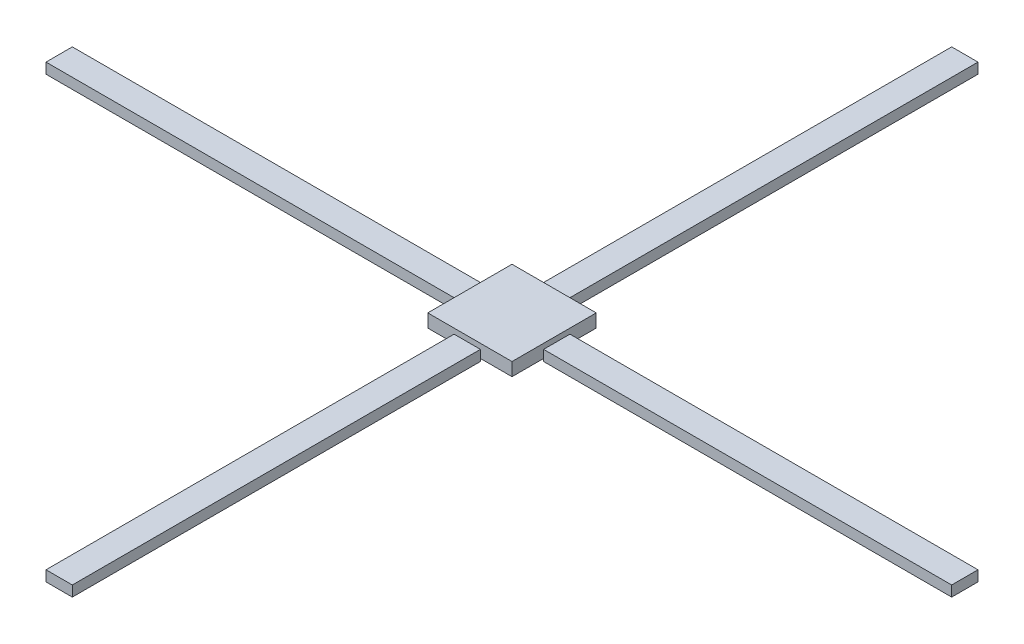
SolidWorks part; units mm, degrees
ref_plane "Front Plane" through (0, 0, 0) normal (0, 0, 1) x (1, 0, 0)
ref_plane "Top Plane" through (0, 0, 0) normal (0, 1, 0) x (1, 0, 0)
ref_plane "Right Plane" through (0, 0, 0) normal (1, 0, 0) x (0, 0, -1)
sketch "Sketch1" plane through (0, 0, 0) normal (0, 1, 0) x (1, 0, 0)
  line L1 (8500, -2500) -> (86000, -2500)
  line L2 (8500, -2500) -> (8500, 2500)
  line L3 (8500, 2500) -> (86000, 2500)
  line L4 (86000, -2500) -> (86000, 2500)
  line L5 (-86000, -2500) -> (-8500, -2500)
  line L6 (-86000, -2500) -> (-86000, 2500)
  line L7 (-86000, 2500) -> (-8500, 2500)
  line L8 (-8500, -2500) -> (-8500, 2500)
  line L9 (-2500, 8500) -> (2500, 8500)
  line L10 (-2500, 8500) -> (-2500, 86000)
  line L11 (-2500, 86000) -> (2500, 86000)
  line L12 (2500, 8500) -> (2500, 86000)
  line L13 (-2500, -86000) -> (2500, -86000)
  line L14 (-2500, -86000) -> (-2500, -8500)
  line L15 (-2500, -8500) -> (2500, -8500)
  line L16 (2500, -86000) -> (2500, -8500)
extrude "Boss-Extrude1" add sketch "Sketch1" along normal blind 2000
sketch "Sketch2" plane through (0, 0, 0) normal (0, 1, 0) x (1, 0, 0)
  line L1 (-8000, -8000) -> (8000, -8000)
  line L2 (-8000, -8000) -> (-8000, 8000)
  line L3 (-8000, 8000) -> (8000, 8000)
  line L4 (8000, -8000) -> (8000, 8000)
extrude "Boss-Extrude2" add sketch "Sketch2" along normal blind 2500
